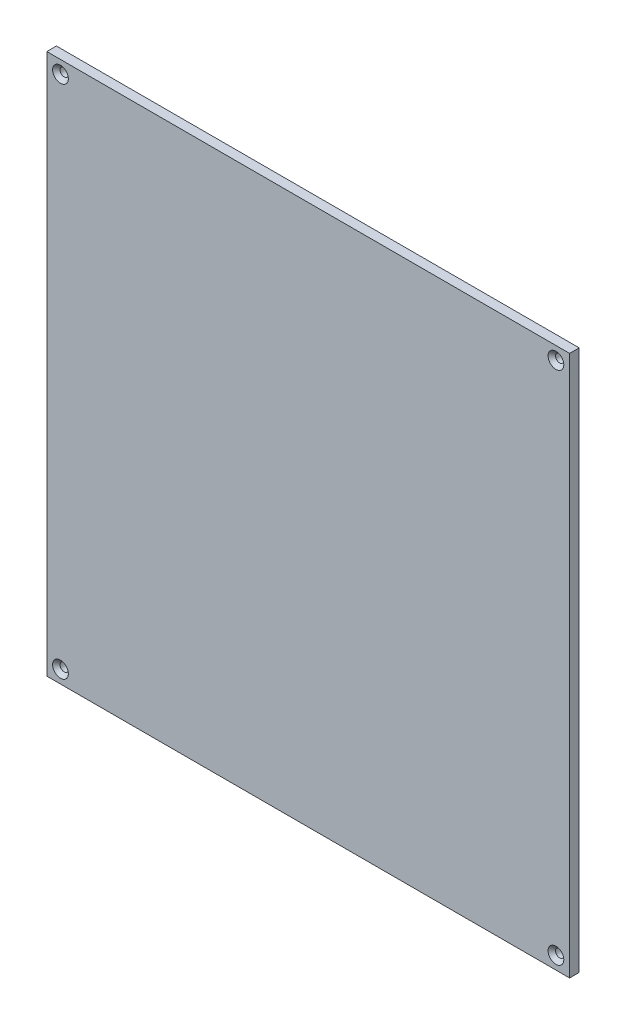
SolidWorks part; units mm, degrees
ref_plane "Front Plane" through (0, 0, 0) normal (0, 0, 1) x (1, 0, 0)
ref_plane "Top Plane" through (0, 0, 0) normal (0, 1, 0) x (1, 0, 0)
ref_plane "Right Plane" through (0, 0, 0) normal (1, 0, 0) x (0, 0, -1)
sketch "Model" plane through (0, 0, 0) normal (0, 0, 1) x (1, 0, 0)
  line L0 (-173, 179) -> (173, 179)
  line L1 (-173, -179) -> (173, -179)
  line L7 (-173, -179) -> (-173, 179)
  line L14 (173, 0) -> (-173, 0) construction
  line L18 (0, 179) -> (0, -179) construction
  line L23 (173, 179) -> (173, -179)
  point P1 (0, 0)
  dimension "D1" = 358
  dimension "D2" = 346
extrude "Boss-Extrude1" add sketch "Model" along normal blind 6.35
sketch "Sketch2" plane through (0, 0, 6.35) normal (0, 0, 1) x (1, 0, 0)
  line L0 (173, 0) -> (-173, 0) construction
  line L1 (173, 179) -> (173, -179) construction
  line L2 (-173, -179) -> (-173, 179) construction
  line L3 (0, 179) -> (0, -179) construction
  line L6 (-173, 179) -> (173, 179) construction
  line L7 (-173, -179) -> (173, -179) construction
  circle A0 centre (-163.95, 170.5) radius 2.55
  circle A1 centre (163.95, 170.5) radius 2.55
  circle A2 centre (163.95, -170.5) radius 2.55
  circle A3 centre (-163.95, -170.5) radius 2.55
  dimension "D1" = 5.1
  dimension "D3" = 341
  dimension "D2" = 327.9
extrude "Cut-Extrude1" cut sketch "Sketch2" against normal up to next contours A0 | A3 | A2 | A1
hole_wizard "CSK for M5 Flat Head Machine Screw1" positions "Sketch3" profile "Sketch4" countersink size "M5" standard "ANSI Metric"
sketch "Sketch3" plane through (0, 0, 6.35) normal (0, 0, 1) x (1, 0, 0)
  point P0 (-163.95, 170.5)
  point P3 (163.95, 170.5)
  point P6 (163.95, -170.5)
  point P9 (-163.95, -170.5)
sketch "Sketch4" plane through (-163.95, 170.5, 6.35) normal (1, 0, 0) x (0, -1, 0)
  line L0 (0, 0) -> (0, 6.35)
  line L1 (0, 6.35) -> (2.75, 6.35)
  line L2 (2.75, 6.35) -> (2.75, 2.45)
  line L3 (2.75, 2.45) -> (5.2, 0)
  line L5 (5.2, 0) -> (0, 0)
  line L6 (-2.75, 2.45) -> (-5.2, 0) construction
  line L11 (0, -6.35) -> (0, 107.95) construction
  dimension "Thru Hole Dia." = 5.5
  dimension "Thru Hole Depth" = 6.35
  dimension "Near C'Sink Dia." = 10.4
  dimension "Near C'Sink Angle" = 90
